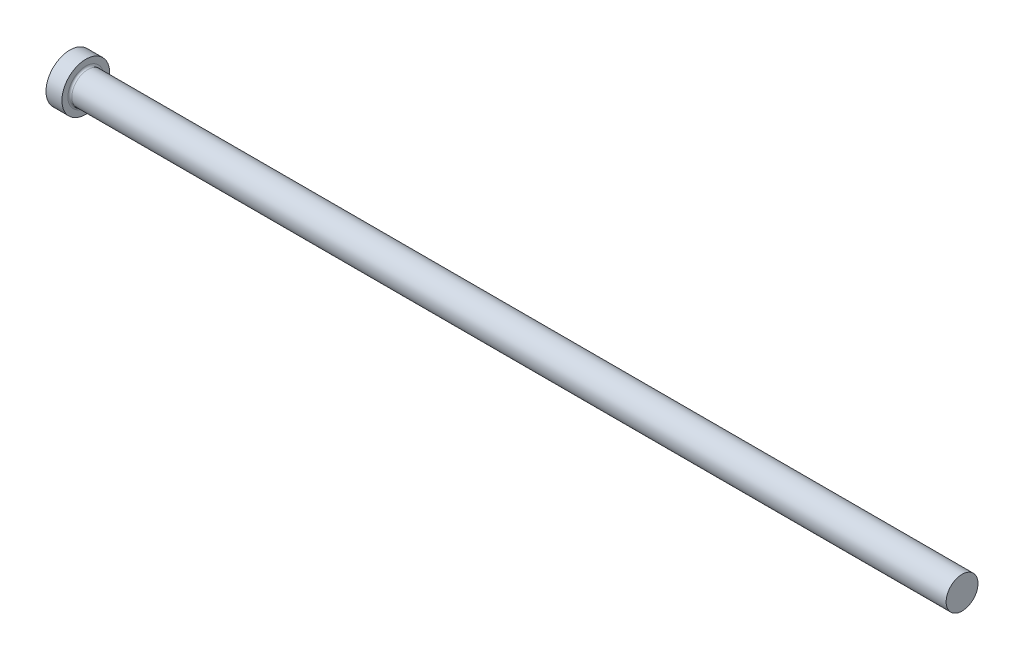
SolidWorks part; units mm, degrees
ref_plane "Front Plane" through (0, 0, 0) normal (0, 0, 1) x (1, 0, 0)
ref_plane "Top Plane" through (0, 0, 0) normal (0, 1, 0) x (1, 0, 0)
ref_plane "Right Plane" through (0, 0, 0) normal (1, 0, 0) x (0, 0, -1)
sketch "Sketch1" plane through (0, 0, 0) normal (0, 0, 1) x (1, 0, 0)
  line L0 (0, 0) -> (0, 9.525)
  line L1 (0, 9.525) -> (6.35, 9.525)
  line L2 (6.35, 9.525) -> (6.35, 7.1374)
  line L3 (7.1374, 6.35) -> (355.6, 6.35)
  line L4 (355.6, 6.35) -> (355.6, 0)
  line L5 (355.6, 0) -> (0, 0)
  line L6 (355.6, 0) -> (0, 0) construction
  line L7 (0, 0) -> (-10.4771, 0) construction
  line L8 (355.6, 0) -> (1002.3976, 0) construction
  arc A0 (7.1374, 6.35) -> (6.35, 7.1374) centre (7.1374, 7.1374) cw
  dimension "D1" = 0.7874
  dimension "HeadDia" = 19.05
  dimension "HeadThickness" = 6.35
  dimension "PinDia" = 12.7
  dimension "overall" = 355.6
revolve "PIN" add sketch "Sketch1" angle 360 about L6
